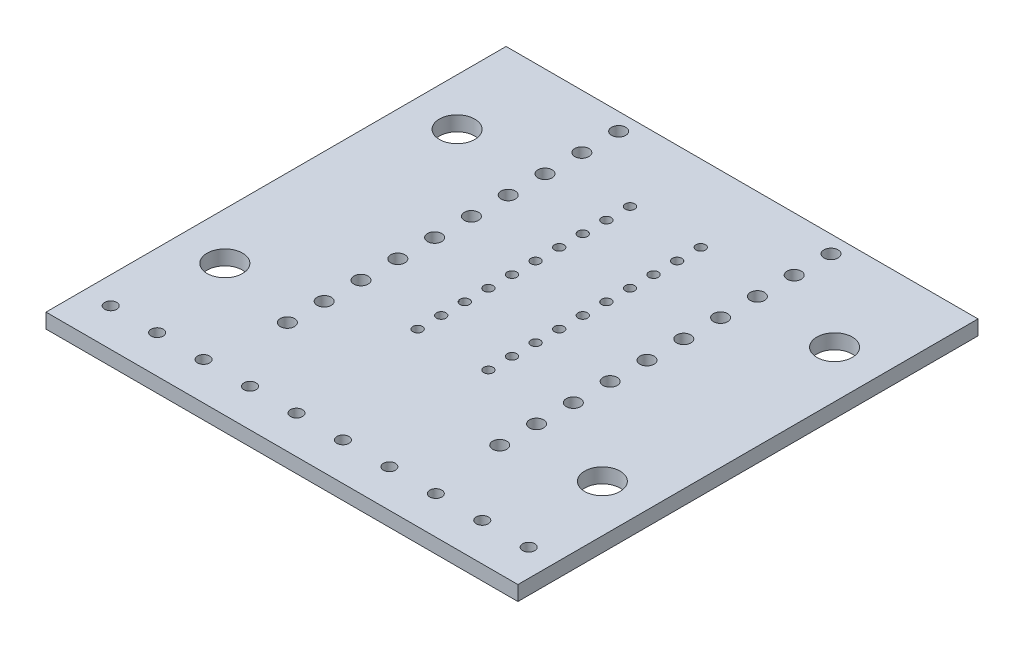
SolidWorks part; units mm, degrees
ref_plane "Front Plane" through (0, 0, 0) normal (0, 0, 1) x (1, 0, 0)
ref_plane "Top Plane" through (0, 0, 0) normal (0, 1, 0) x (1, 0, 0)
ref_plane "Right Plane" through (0, 0, 0) normal (1, 0, 0) x (0, 0, -1)
sketch "Sketch1" plane through (0, 0, 0) normal (0, 1, 0) x (1, 0, 0)
  line L0 (0, 0) -> (0, 49.53) construction
  line L1 (-25.4, 49.53) -> (25.4, 49.53)
  line L2 (-25.4, 49.53) -> (-25.4, 0)
  line L3 (-25.4, 0) -> (25.4, 0)
  line L4 (25.4, 49.53) -> (25.4, 0)
  line L5 (-11.43, 12.0142) -> (-11.43, 15.9766) construction
  line L6 (-3.81, 18.415) -> (-3.81, 20.955) construction
  line L7 (3.81, 18.415) -> (3.81, 20.955) construction
  line L8 (11.43, 12.0142) -> (11.43, 15.9766) construction
  circle A0 centre (-22.4993, 4.064) radius 0.65
  circle A1 centre (-17.5006, 4.064) radius 0.65
  circle A2 centre (-12.4993, 4.064) radius 0.65
  circle A3 centre (-7.5006, 4.064) radius 0.65
  circle A4 centre (-2.4994, 4.064) radius 0.65
  circle A5 centre (-20.32, 14.1732) radius 1.905
  circle A6 centre (-20.32, 39.1693) radius 1.905
  circle A7 centre (-11.43, 12.0142) radius 0.762
  circle A8 centre (-11.43, 15.9766) radius 0.762
  circle A9 centre (-11.43, 19.939) radius 0.762
  circle A10 centre (-11.43, 23.9014) radius 0.762
  circle A11 centre (-11.43, 27.8638) radius 0.762
  circle A12 centre (-11.43, 31.8262) radius 0.762
  circle A13 centre (-11.43, 35.7886) radius 0.762
  circle A14 centre (-11.43, 39.751) radius 0.762
  circle A15 centre (-11.43, 43.7134) radius 0.762
  circle A16 centre (-11.43, 47.6758) radius 0.762
  circle A17 centre (-3.81, 18.415) radius 0.508
  circle A18 centre (3.81, 41.275) radius 0.508
  circle A19 centre (3.81, 38.735) radius 0.508
  circle A20 centre (3.81, 36.195) radius 0.508
  circle A21 centre (3.81, 33.655) radius 0.508
  circle A22 centre (3.81, 31.115) radius 0.508
  circle A23 centre (3.81, 28.575) radius 0.508
  circle A24 centre (3.81, 26.035) radius 0.508
  circle A25 centre (3.81, 23.495) radius 0.508
  circle A26 centre (3.81, 20.955) radius 0.508
  circle A27 centre (3.81, 18.415) radius 0.508
  circle A28 centre (-3.81, 20.955) radius 0.508
  circle A29 centre (-3.81, 23.495) radius 0.508
  circle A30 centre (-3.81, 26.035) radius 0.508
  circle A31 centre (-3.81, 28.575) radius 0.508
  circle A32 centre (-3.81, 31.115) radius 0.508
  circle A33 centre (-3.81, 33.655) radius 0.508
  circle A34 centre (-3.81, 36.195) radius 0.508
  circle A35 centre (-3.81, 38.735) radius 0.508
  circle A36 centre (-3.81, 41.275) radius 0.508
  circle A37 centre (-1.27, 18.415) radius 0.508
  circle A38 centre (-1.27, 20.955) radius 0.508
  circle A39 centre (-1.27, 23.495) radius 0.508
  circle A40 centre (-1.27, 26.035) radius 0.508
  circle A41 centre (-1.27, 28.575) radius 0.508
  circle A42 centre (-1.27, 31.115) radius 0.508
  circle A43 centre (-1.27, 33.655) radius 0.508
  circle A44 centre (-1.27, 36.195) radius 0.508
  circle A45 centre (-1.27, 38.735) radius 0.508
  circle A46 centre (-1.27, 41.275) radius 0.508
  circle A47 centre (11.43, 47.6758) radius 0.762
  circle A48 centre (11.43, 43.7134) radius 0.762
  circle A49 centre (11.43, 39.751) radius 0.762
  circle A50 centre (11.43, 35.7886) radius 0.762
  circle A51 centre (11.43, 31.8262) radius 0.762
  circle A52 centre (11.43, 27.8638) radius 0.762
  circle A53 centre (11.43, 23.9014) radius 0.762
  circle A54 centre (11.43, 19.939) radius 0.762
  circle A55 centre (11.43, 15.9766) radius 0.762
  circle A56 centre (11.43, 12.0142) radius 0.762
  circle A57 centre (20.32, 39.1693) radius 1.905
  circle A58 centre (20.32, 14.1732) radius 1.905
  circle A59 centre (2.4994, 4.064) radius 0.65
  circle A60 centre (7.5006, 4.064) radius 0.65
  circle A61 centre (12.4993, 4.064) radius 0.65
  circle A62 centre (17.5006, 4.064) radius 0.65
  circle A63 centre (22.4993, 4.064) radius 0.65
  point P4 (0, 0)
other "AlignGroup1" parameters "D3"=1.7432, "D10"=1.7432, "D11"=4.3333, "D13"=3.6972, "D15"=1.241, "D18"=1.016, "D20"=0.7684, "D22"=0.7684, "D1"=97.6248, "D2"=59.5704, "D4"=0, "D5"=2.4994, "D6"=7.5006, "D7"=12.4993, "D8"=17.5006, "D9"=22.4993, "D12"=50.8, "D14"=49.53, "D17"=3.9624, "D19"=50.8, "D21"=50.8, "D25"=2.54, "D16"=10, "D23"=2, "D24"=10
extrude "Boss-Extrude1" add sketch "Sketch1" along normal blind 1.5875
